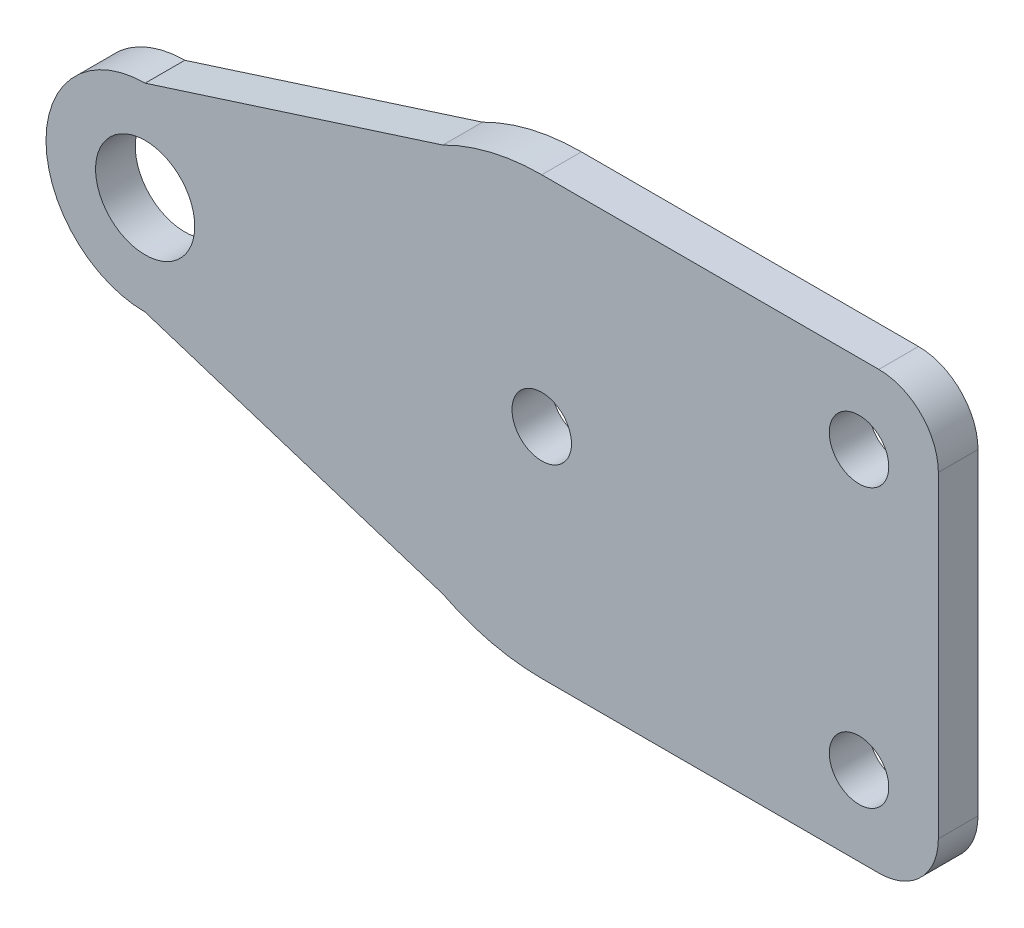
SolidWorks part; units mm, degrees
ref_plane "Plan de face" through (0, 0, 0) normal (0, 0, 1) x (1, 0, 0)
ref_plane "Plan de dessus" through (0, 0, 0) normal (0, 1, 0) x (1, 0, 0)
ref_plane "Plan de droite" through (0, 0, 0) normal (1, 0, 0) x (0, 0, -1)
sketch "Esquisse1" plane through (0, 0, 0) normal (0, 0, 1) x (1, 0, 0)
  line L0 (0, 11) -> (17, 11)
  line L1 (20, 8) -> (20, -8)
  line L2 (17, -11) -> (0, -11)
  line L3 (0, 0) -> (22.9627, 0) construction
  line L4 (-20, -5) -> (-4.9879, -9.8041)
  line L5 (-20, 5) -> (-4.9879, 9.8041)
  circle A0 centre (16, 7) radius 1.5
  circle A1 centre (0, 0) radius 1.5
  arc A2 (20, 8) -> (17, 11) centre (17, 8) ccw
  arc A3 (20, -8) -> (17, -11) centre (17, -8) cw
  circle A5 centre (16, -7) radius 1.5
  circle A6 centre (-20, 0) radius 2.5
  arc A7 (-4.9879, 9.8041) -> (0, 11) centre (0, 0) cw
  arc A8 (-20, -5) -> (-20, 5) centre (-20, 0) cw
  arc A9 (-4.9879, -9.8041) -> (0, -11) centre (0, 0) ccw
  dimension "D1" = 3
  dimension "D2" = 3
  dimension "D4" = 3
  dimension "D7" = 5
  dimension "D3" = 20
  dimension "D5" = 4
  dimension "D6" = 4
  dimension "D9" = 20
extrude "Extrusion1" add sketch "Esquisse1" along normal blind 2
